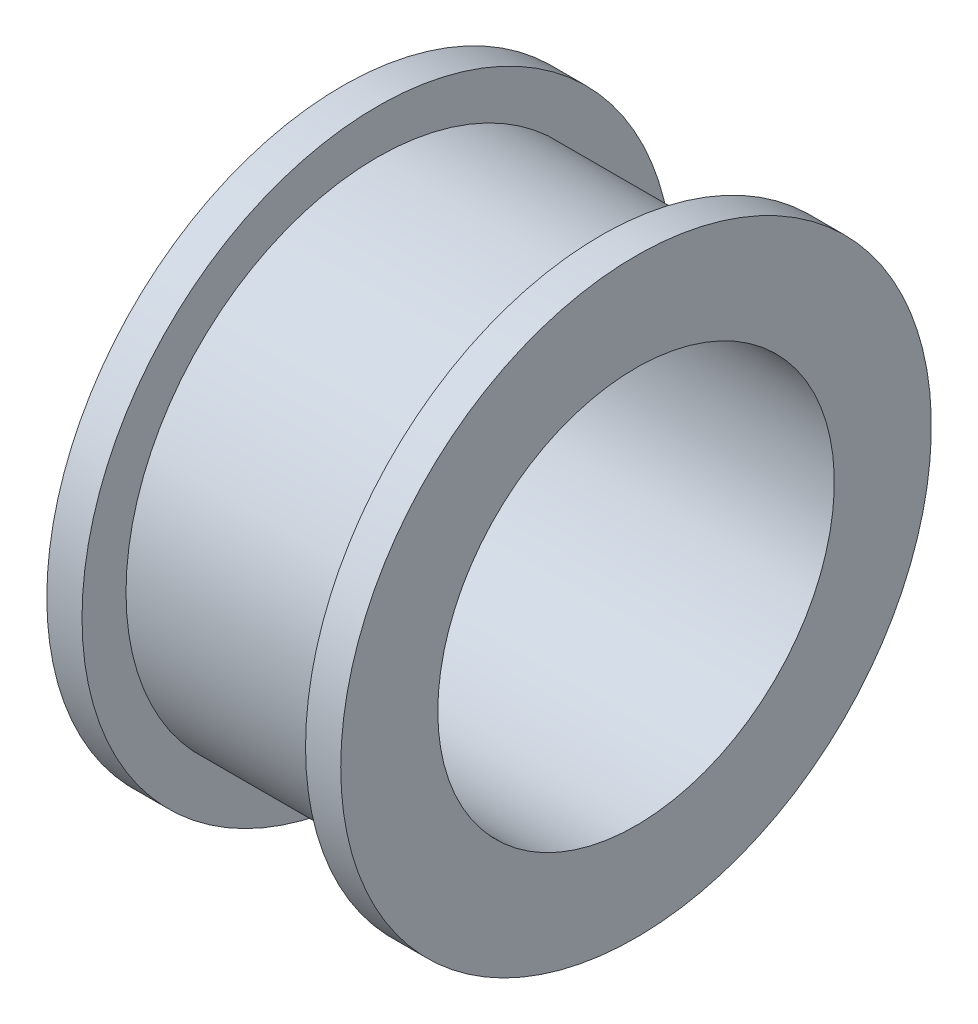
SolidWorks part; units mm, degrees
ref_plane "Front Plane" through (0, 0, 0) normal (0, 0, 1) x (1, 0, 0)
ref_plane "Top Plane" through (0, 0, 0) normal (0, 1, 0) x (1, 0, 0)
ref_plane "Right Plane" through (0, 0, 0) normal (1, 0, 0) x (0, 0, -1)
sketch "Sketch1" plane through (0, 0, 0) normal (0, 0, 1) x (1, 0, 0)
  line L0 (-17.8256, -0.6921) -> (-17.8256, 6.3119)
  line L1 (-17.8256, 6.3119) -> (-15.2856, 6.3119)
  line L2 (-15.2856, 6.3119) -> (-15.2856, 3.1369)
  line L3 (-15.2856, 3.1369) -> (0.8434, 3.1369)
  line L4 (0.8434, 3.1369) -> (0.8434, 6.3119)
  line L5 (0.8434, 6.3119) -> (3.3834, 6.3119)
  line L6 (3.3834, 6.3119) -> (3.3834, -0.6921)
  line L7 (3.3834, -0.6921) -> (-17.8256, -0.6921)
  line L8 (-37.3662, -14.9987) -> (54.837, -14.9987) construction
  dimension "D1" = 14.3065
  dimension "D2" = 16.129
  dimension "D3" = 2.54
  dimension "D4" = 2.54
  dimension "D5" = 18.1356
  dimension "D6" = 3.175
  dimension "D7" = 3.175
revolve "Revolve1" add sketch "Sketch1" angle 360 about L8
